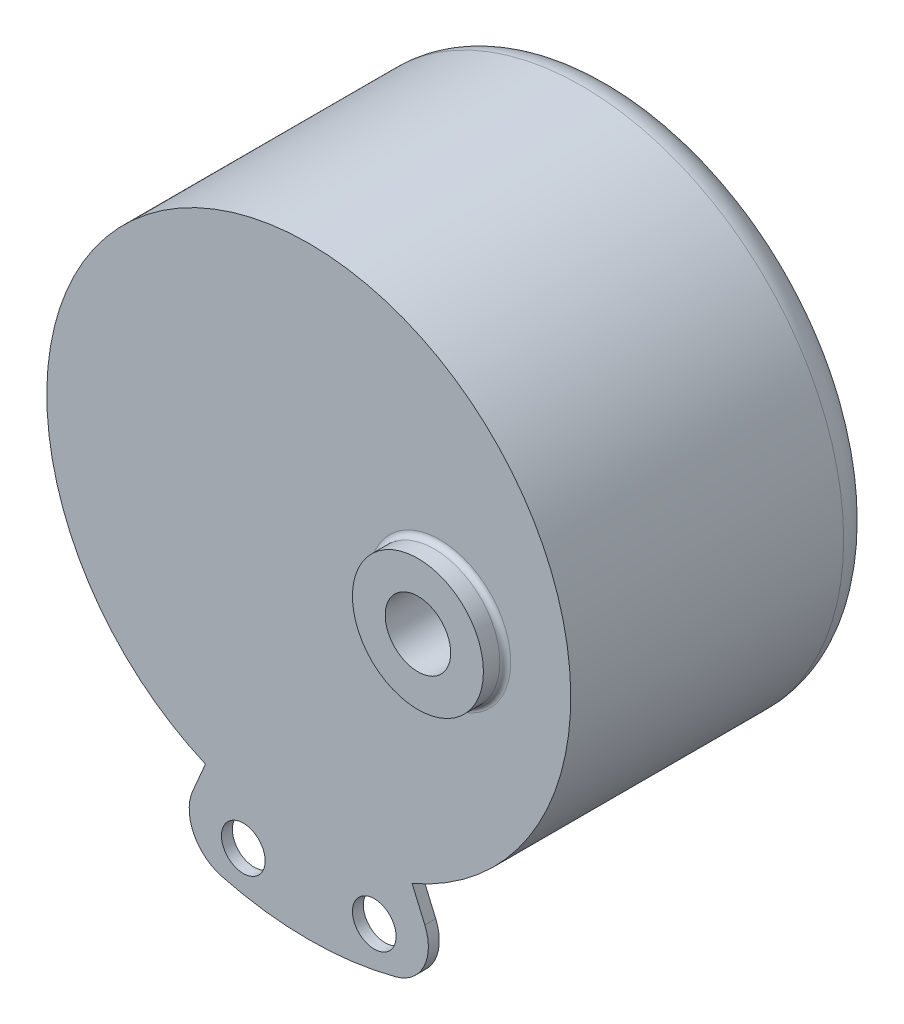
SolidWorks part; units mm, degrees
ref_plane "Plan de face" through (0, 0, 0) normal (0, 0, 1) x (1, 0, 0)
ref_plane "Plan de dessus" through (0, 0, 0) normal (0, 1, 0) x (1, 0, 0)
ref_plane "Plan de droite" through (0, 0, 0) normal (1, 0, 0) x (0, 0, -1)
sketch "Esquisse1" plane through (0, 0, 0) normal (0, 0, 1) x (1, 0, 0)
  circle A0 centre (0, 0) radius 24
extrude "Boss.-Extru.1" add sketch "Esquisse1" along normal blind 28
sketch "Esquisse2" plane through (0, 0, 28) normal (0, 0, 1) x (1, 0, 0)
  circle A0 centre (12, 0) radius 6
  dimension "D2" = 12
  dimension "D1" = 12
extrude "Boss.-Extru.2" add sketch "Esquisse2" along normal blind 2
fillet "Congé1" radius 3 1 edges at (24, 0, 0)
fillet "Congé2" radius 0.5 1 edges at (18, 0, 28)
sketch "Esquisse3" plane through (0, 0, 30) normal (0, 0, 1) x (1, 0, 0)
  circle A0 centre (12, 0) radius 3
extrude "Enlèv. mat.-Extru.1" cut sketch "Esquisse3" against normal blind 10
sketch "Esquisse4" plane through (0, 0, 28) normal (0, 0, 1) x (1, 0, 0)
  line L0 (-43.0682, -27) -> (50.5763, -27) construction
  line L1 (0, -7.4637) -> (0, -37.8074) construction
  line L2 (9.4666, -22.0541) -> (10.6308, -24.7664)
  line L3 (-9.4666, -22.0541) -> (-10.6308, -24.7664)
  circle A0 centre (0, 0) radius 24 construction
  arc A1 (-7.9762, -30.2116) -> (7.9762, -30.2116) centre (0, 0) ccw
  circle A2 centre (6, -27) radius 2
  circle A3 centre (-6, -27) radius 2
  arc A4 (7.9762, -30.2116) -> (10.6308, -24.7664) centre (6.9551, -26.3441) ccw
  arc A5 (-7.9762, -30.2116) -> (-10.6308, -24.7664) centre (-6.9551, -26.3441) cw
  arc A6 (-9.4666, -22.0541) -> (9.4666, -22.0541) centre (0, 0) ccw
  dimension "D1" = 27
  dimension "D2" = 12
  dimension "D3" = 4
  dimension "D4" = 4
extrude "Boss.-Extru.3" add sketch "Esquisse4" against normal blind 1
